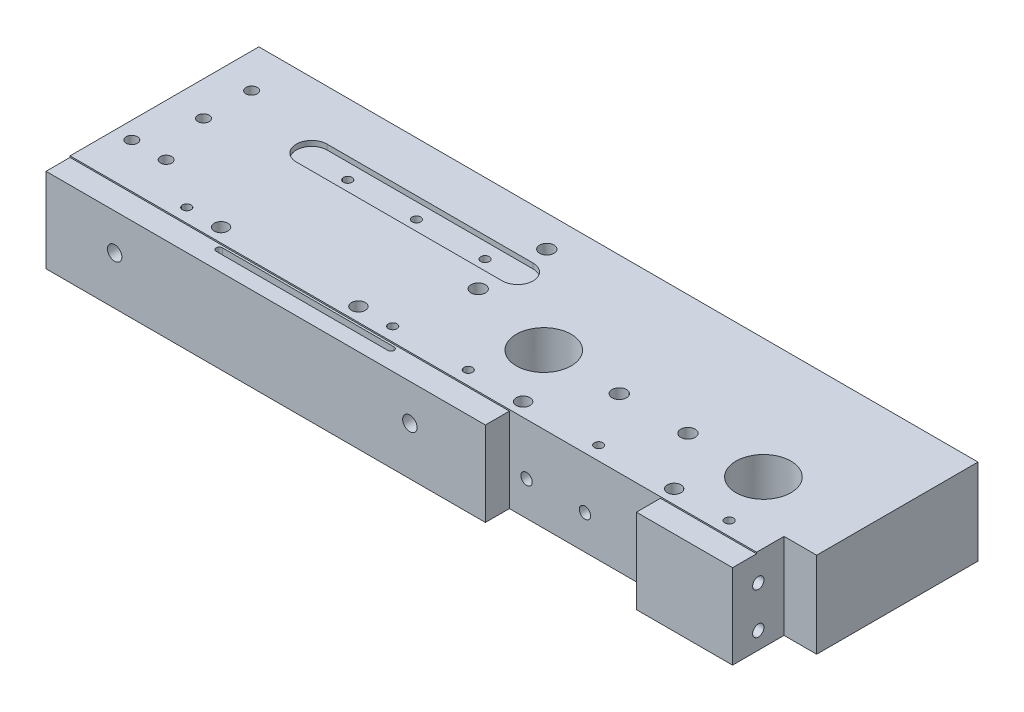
SolidWorks part; units mm, degrees
ref_plane "前视基准面" through (0, 0, 0) normal (0, 0, 1) x (1, 0, 0)
ref_plane "上视基准面" through (0, 0, 0) normal (0, 1, 0) x (1, 0, 0)
ref_plane "右视基准面" through (0, 0, 0) normal (1, 0, 0) x (0, 0, -1)
sketch "草图1" plane through (0, 0, 0) normal (0, 0, 1) x (1, 0, 0)
  line L0 (209.5, 0) -> (209.5, 25)
  line L1 (0, 0) -> (0, 25)
  line L2 (0, 25) -> (209.5, 25)
  line L3 (0, 0) -> (209.5, 0)
extrude "凸台-拉伸1" add sketch "草图1" along normal blind 62
sketch "草图2" plane through (0, 25, 0) normal (0, 1, 0) x (1, 0, 0)
  line L0 (128, -55) -> (172, -55)
  line L1 (0, 0) -> (209.5, 0)
  line L2 (0, -62) -> (0, 0)
  line L3 (128, -62) -> (128, -55)
  line L4 (172, -62) -> (172, -55)
  line L5 (209.5, -47) -> (209.5, 0)
  line L6 (172, -62) -> (200, -62)
  line L7 (0, -62) -> (128, -62)
  line L10 (200, -47) -> (209.5, -47)
  line L11 (200, -47) -> (200, -62)
  circle A0 centre (118, -35) radius 8
  circle A1 centre (182, -35) radius 8
extrude "切除-拉伸1" cut sketch "草图2" against normal blind 62 flip side to cut
sketch "草图3" plane through (0, 25, 0) normal (0, 1, 0) x (1, 0, 0)
  line L0 (45, -55.6) -> (95, -55.6)
  line L1 (45, -57.4) -> (95, -57.4)
  arc A0 (45, -55.6) -> (45, -57.4) centre (45, -56.5) ccw
  arc A1 (95, -57.4) -> (95, -55.6) centre (95, -56.5) ccw
extrude "切除-拉伸2" cut sketch "草图3" against normal blind 62
sketch "草图4" plane through (0, 25, 0) normal (0, 1, 0) x (1, 0, 0)
  line L0 (34.5, -14.6) -> (94.5, -14.6)
  line L1 (34.5, -23.6) -> (94.5, -23.6)
  arc A0 (94.5, -23.6) -> (94.5, -14.6) centre (94.5, -19.1) ccw
  arc A1 (34.5, -14.6) -> (34.5, -23.6) centre (34.5, -19.1) ccw
extrude "切除-拉伸3" cut sketch "草图4" against normal blind 1.5
sketch "草图5" plane through (0, 25, 0) normal (0, 1, 0) x (1, 0, 0)
  line L0 (0, -55) -> (128, -55)
  line L1 (0, -62) -> (0, -55)
  line L2 (128, -62) -> (128, -55)
  line L3 (172, -62) -> (172, -55)
  line L4 (172, -62) -> (200, -62)
  line L5 (0, -62) -> (128, -62)
  line L6 (200, -55) -> (200, -62)
  line L7 (172, -55) -> (200, -55)
extrude "切除-拉伸4" cut sketch "草图5" against normal blind 0.4
sketch "草图6" plane through (0, 25, 0) normal (0, 1, 0) x (1, 0, 0)
  circle A0 centre (128, -51) radius 2
  circle A1 centre (172, -51) radius 2
  circle A2 centre (112, -51) radius 1.25
  circle A3 centre (150, -51) radius 1.25
  circle A4 centre (188, -51) radius 1.25
  circle A5 centre (140, -35) radius 2.1
  circle A6 centre (160, -35) radius 2.1
  circle A7 centre (30, -51) radius 1.25
  circle A8 centre (90, -51) radius 1.25
  circle A9 centre (40, -51) radius 2
  circle A10 centre (80, -51) radius 2
  circle A11 centre (15, -42) radius 1.65
  circle A12 centre (5, -42) radius 1.65
  circle A13 centre (10, -12.1) radius 1.65
  circle A14 centre (10, -26.1) radius 1.65
  circle A15 centre (93, -9.1) radius 2.1
  circle A16 centre (93, -29.1) radius 2.1
extrude "切除-拉伸5" cut sketch "草图6" against normal blind 15
sketch "草图7" plane through (0, 23.5, 0) normal (0, 1, 0) x (1, 0, 0)
  circle A0 centre (85, -19.1) radius 1.25
  circle A1 centre (65, -19.1) radius 1.25
  circle A2 centre (45, -19.1) radius 1.25
extrude "切除-拉伸6" cut sketch "草图7" against normal blind 15
sketch "草图8" plane through (0, 25, 0) normal (0, 1, 0) x (1, 0, 0)
  circle A0 centre (182, -35) radius 12.5 construction
  circle A1 centre (118, -35) radius 12.5 construction
sketch "草图9" plane through (0, 0, 0) normal (0, -1, 0) x (1, 0, 0)
  circle A0 centre (118, 35) radius 12.5
  circle A1 centre (182, 35) radius 12.5
extrude "切除-拉伸7" cut sketch "草图9" against normal blind 13
sketch "草图10" plane through (0, 0, 55) normal (0, 0, 1) x (1, 0, 0)
  circle A0 centre (133, 10) radius 1.65
  circle A1 centre (150, 10) radius 1.65
  circle A2 centre (167, 10) radius 1.65
extrude "切除-拉伸8" cut sketch "草图10" against normal blind 13
sketch "草图11" plane through (0, 0, 62) normal (0, 0, 1) x (1, 0, 0)
  circle A0 centre (106, 14) radius 2.1
  circle A1 centre (20, 14) radius 2.1
extrude "切除-拉伸9" cut sketch "草图11" against normal blind 13
sketch "草图12" plane through (0, 25, 0) normal (0, 1, 0) x (1, 0, 0)
  circle A0 centre (110, -10) radius 3.375 construction
  circle A1 centre (190, -10) radius 3.375 construction
  circle A2 centre (25, -10) radius 3.375 construction
  circle A3 centre (25, -35) radius 3.375 construction
sketch "草图13" plane through (0, 0, 0) normal (0, -1, 0) x (1, 0, 0)
  circle A0 centre (25, 35) radius 3.375
  circle A1 centre (25, 10) radius 3.5
  circle A2 centre (110, 10) radius 3.375
  circle A3 centre (190, 10) radius 3.375
extrude "切除-拉伸10" cut sketch "草图13" against normal blind 13
sketch "草图14" plane through (200, 0, 0) normal (1, 0, 0) x (0, 0, -1)
  circle A0 centre (-54.5, 17) radius 1.65
  circle A1 centre (-54.5, 5) radius 1.65
extrude "切除-拉伸11" cut sketch "草图14" against normal blind 10
